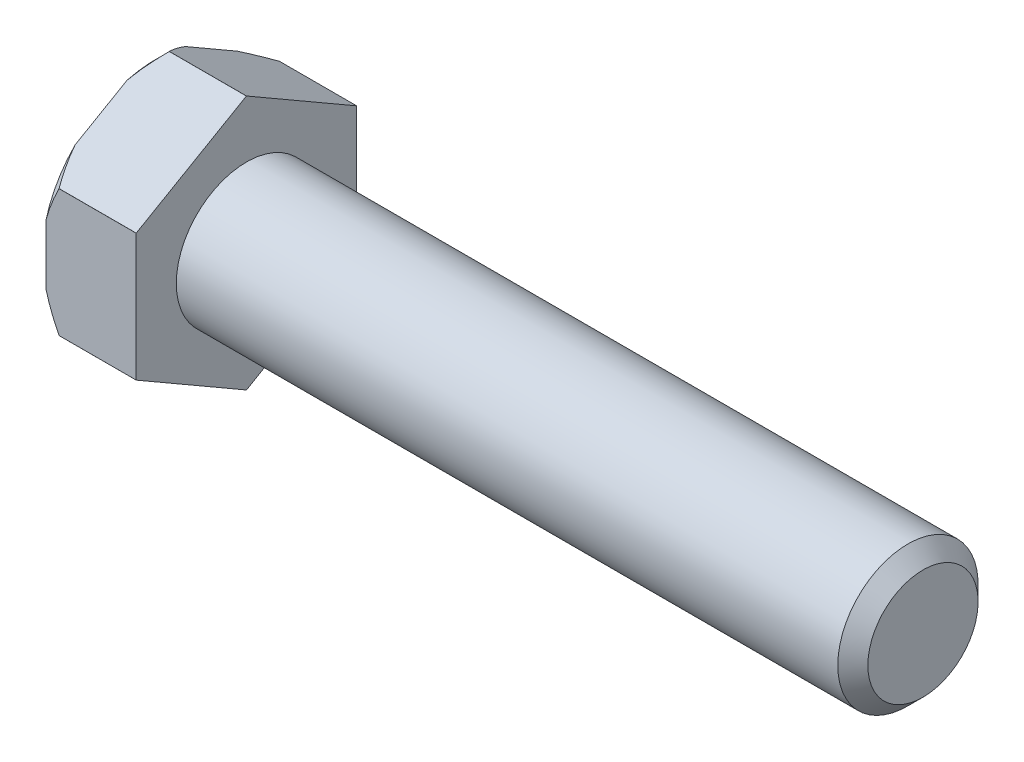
SolidWorks part; units mm, degrees
ref_plane "Plan1" through (0, 0, 0) normal (0, 0, 1) x (1, 0, 0)
ref_plane "Plan2" through (0, 0, 0) normal (0, 1, 0) x (1, 0, 0)
ref_plane "Plan3" through (0, 0, 0) normal (1, 0, 0) x (0, 0, -1)
sketch "Esquisse1" plane through (0, 0, 0) normal (0, 0, 1) x (1, 0, 0)
  line L0 (-49.2335, 0) -> (51.0797, 0) construction
  line L1 (-9, 0) -> (-9, 12.7)
  line L2 (-9, 12.7) -> (0, 12.7)
  line L3 (0, 12.7) -> (0, 7)
  line L4 (0, 7) -> (67.5, 7)
  line L5 (67.5, 7) -> (67.5, 0)
  line L6 (-9, 0) -> (67.5, 0)
  dimension "D1" = 7
  dimension "D2" = 9
  dimension "D3" = 9
  dimension "D4" = 67.5
  dimension "D5" = 12.7
revolve "Base-Révolution" add sketch "Esquisse1"
chamfer "Chanfrein2" distance 1.5 angle 45 1 edges at (67.5, 0, 7)
chamfer "Chanfrein1" distance 1.3 angle 45 1 edges at (-9, 0, 12.7)
sketch "Esquisse2" plane through (-9, 0, 0) normal (-1, 0, 0) x (0, 0, 1)
  line L0 (-11, 6.3509) -> (0, 12.7017)
  line L1 (0, 12.7017) -> (11, 6.3509)
  line L2 (11, 6.3509) -> (11, -6.3509)
  line L3 (0, -12.7017) -> (11, -6.3509)
  line L4 (-11, -6.3509) -> (0, -12.7017)
  line L11 (-11, 6.3509) -> (-11, -6.3509)
extrude "Enlèv. mat.-Extru.1" cut sketch "Esquisse2" against normal through all flip side to cut
